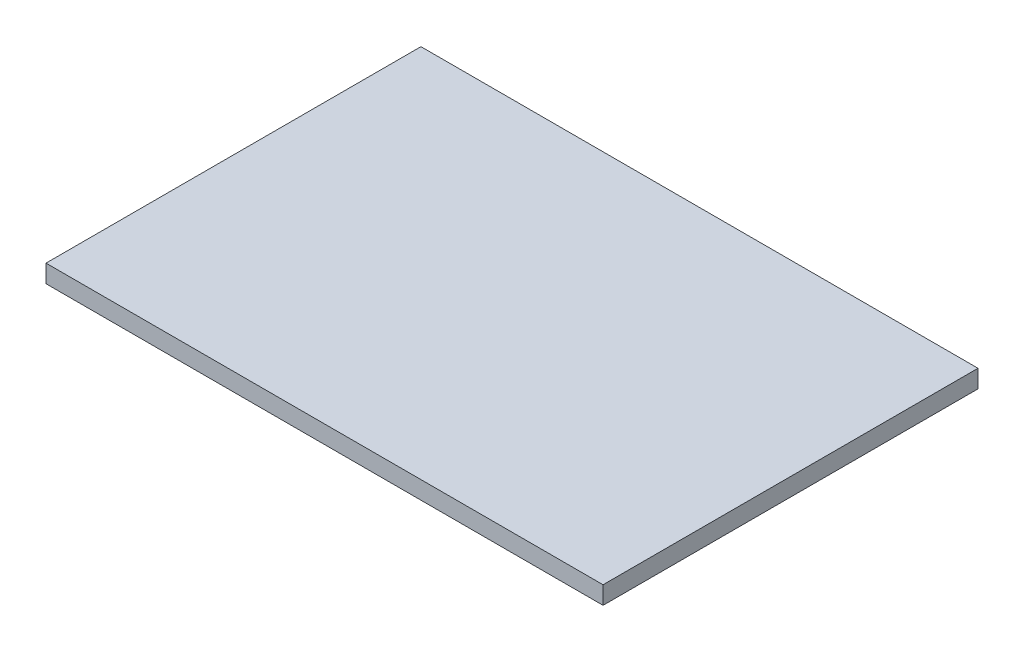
SolidWorks part; units mm, degrees
ref_plane "Plan de face" through (0, 0, 0) normal (0, 0, 1) x (1, 0, 0)
ref_plane "Plan de dessus" through (0, 0, 0) normal (0, 1, 0) x (1, 0, 0)
ref_plane "Plan de droite" through (0, 0, 0) normal (1, 0, 0) x (0, 0, -1)
sketch "Esquisse1" plane through (0, 0, 0) normal (0, 0, 1) x (1, 0, 0)
  line L1 (205.8447, 39.1997) -> (-106.1553, 39.1997)
  line L2 (205.8447, 39.1997) -> (205.8447, 49.1997)
  line L3 (205.8447, 49.1997) -> (-106.1553, 49.1997)
  line L4 (-106.1553, 39.1997) -> (-106.1553, 49.1997)
  dimension "D1" = 10
  dimension "D2" = 312
extrude "Boss.-Extru.1" add sketch "Esquisse1" along normal blind 210
